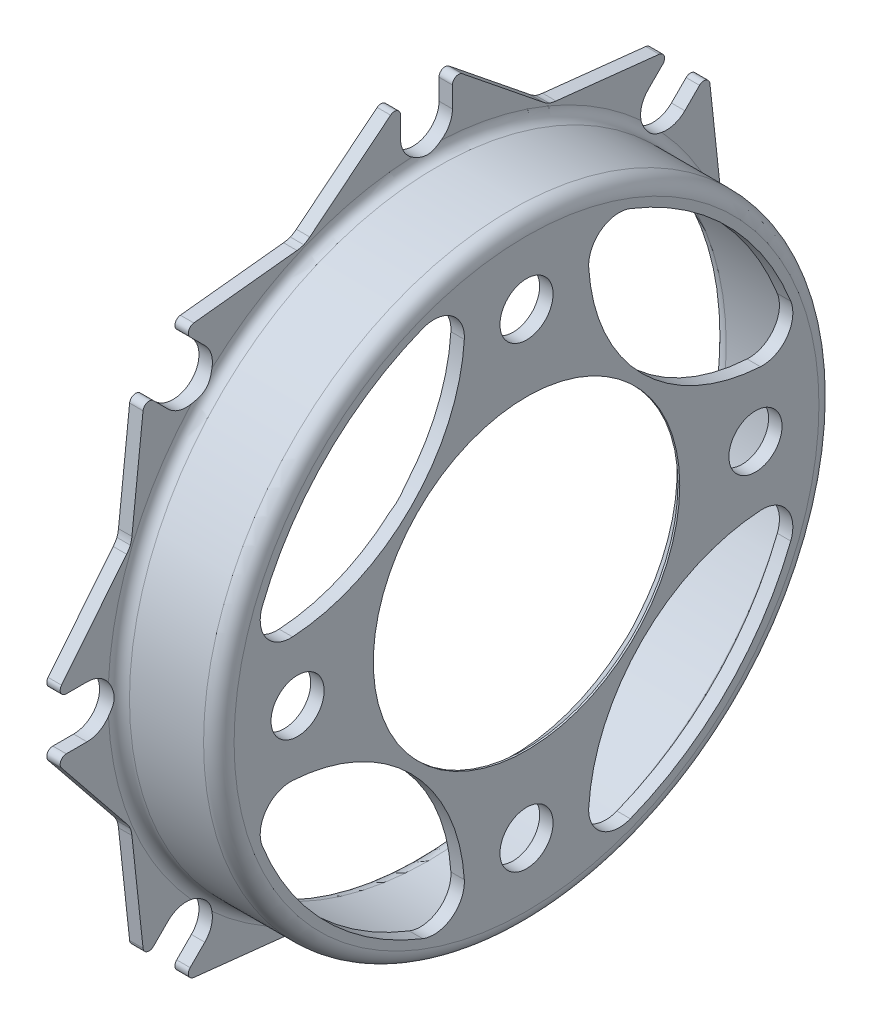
SolidWorks part; units mm, degrees
ref_plane "Front Plane" through (0, 0, 0) normal (0, 0, 1) x (1, 0, 0)
ref_plane "Top Plane" through (0, 0, 0) normal (0, 1, 0) x (1, 0, 0)
ref_plane "Right Plane" through (0, 0, 0) normal (1, 0, 0) x (0, 0, -1)
sketch "Sketch1" plane through (0, 0, 0) normal (0, 0, 1) x (1, 0, 0)
  line L0 (20.8102, 34.1272) -> (20.8102, 59.7535)
  line L1 (18.5877, 61.976) -> (3.175, 61.976)
  line L2 (0, 65.151) -> (0, 88.9)
  line L3 (0, 88.9) -> (2.794, 88.9)
  line L4 (2.794, 88.9) -> (2.794, 66.2305)
  line L5 (5.0165, 64.008) -> (20.4292, 64.008)
  line L6 (23.6042, 60.833) -> (23.6042, 31.877)
  line L7 (23.6042, 31.877) -> (23.2232, 31.877)
  line L8 (20.8102, 34.1272) -> (23.2232, 31.877)
  arc A0 (20.4292, 64.008) -> (23.6042, 60.833) centre (20.4292, 60.833) cw
  arc A1 (18.5877, 61.976) -> (20.8102, 59.7535) centre (18.5877, 59.7535) cw
  arc A2 (0, 65.151) -> (3.175, 61.976) centre (3.175, 65.151) ccw
  arc A3 (2.794, 66.2305) -> (5.0165, 64.008) centre (5.0165, 66.2305) ccw
  dimension "D8" = 3.175
  dimension "D9" = 2.2225
  dimension "D10" = 0.381
  dimension "D1" = 64.008
  dimension "D2" = 88.9
  dimension "D3" = 2.032
  dimension "D4" = 2.794
  dimension "D5" = 2.794
  dimension "D6" = 31.877
  dimension "D7" = 23.6042
  dimension "D11" = 47
ref_axis "Axis1" through (24.7844, 0, 0) along (-1, 0, 0)
revolve "Revolve1" add sketch "Sketch1" angle 360 about axis through (24.7844, 0, 0) along (-1, 0, 0)
sketch "Sketch2" plane through (23.6042, 0, 0) normal (1, 0, 0) x (0, 0, -1)
  circle A0 centre (0, 47.625) radius 5.5245
  dimension "D2" = 11.049
  dimension "D1" = 47.625
extrude "Cut-Extrude1" cut sketch "Sketch2" against normal up to next
pattern_circular "CirPattern1" count 4 every 90 about axis through (0, 0, 0) along (1, 0, 0) of "Cut-Extrude1"
sketch "Sketch3" plane through (23.6042, 0, 0) normal (1, 0, 0) x (0, 0, -1)
  line L0 (0, 0) -> (13.5385, 63.6938) construction
  line L1 (0, 0) -> (60.3937, 12.8371) construction
  line L2 (0, 0) -> (0, 62.2775) construction
  line L3 (0, 0) -> (59.5435, 0) construction
  arc A0 (54.9619, 21.6027) -> (21.6027, 54.9619) centre (0, 0) ccw
  arc A1 (12.9415, 48.6681) -> (48.6681, 12.9415) centre (50.9718, 50.9718) ccw
  arc A2 (12.9415, 48.6681) -> (21.6027, 54.9619) centre (19.2799, 49.0521) cw
  arc A3 (54.9619, 21.6027) -> (48.6681, 12.9415) centre (49.0521, 19.2799) cw
  point P15 (-64.0983, -8.6683)
  dimension "D1" = 12
  dimension "D2" = 12
  dimension "D7" = 2.54
  dimension "D3" = 59.055
  dimension "D5" = 2.54
  dimension "D6" = 38.1
  dimension "D4" = 6.35
extrude "Cut-Extrude2" cut sketch "Sketch3" against normal up to next
pattern_circular "CirPattern2" count 4 every 90 about axis through (0, 0, 0) along (1, 0, 0) of "Cut-Extrude2"
sketch "Sketch5" plane through (0, 0, 0) normal (-1, 0, 0) x (0, 0, 1)
  line L0 (-7.464, 75.9192) -> (-24.2802, 62.3787)
  line L1 (7.464, 75.9192) -> (24.2802, 62.3787)
  line L2 (-5.3975, 74.93) -> (-5.3975, 70.612)
  line L3 (5.3975, 70.612) -> (5.3975, 74.93)
  line L4 (0, 0) -> (-61.2529, 147.8776) construction
  line L5 (0, 0) -> (61.0786, 147.4569) construction
  line L6 (0, 0) -> (0, 165.0951) construction
  line L7 (-34.0206, 82.1329) -> (-25.5154, 61.5997)
  line L8 (34.0206, 82.1329) -> (25.5154, 61.5997)
  arc A0 (-5.3975, 74.93) -> (-7.464, 75.9192) centre (-6.6675, 74.93) ccw
  arc A2 (-5.3975, 70.612) -> (5.3975, 70.612) centre (0, 70.612) ccw
  arc A3 (7.464, 75.9192) -> (5.3975, 74.93) centre (6.6675, 74.93) ccw
  circle A5 centre (0, 0) radius 88.9 construction
  arc A8 (-24.2802, 62.3787) -> (-25.5154, 61.5997) centre (-28.2627, 67.3246) cw
  arc A9 (34.0206, 82.1329) -> (-34.0206, 82.1329) centre (0, 0) ccw
  circle A10 centre (0, 0) radius 88.9 construction
  arc A12 (25.5154, 61.5997) -> (24.2802, 62.3787) centre (28.2627, 67.3246) cw
  circle A14 centre (0, 0) radius 66.675 construction
  point P12 (-18.9836, 61.8592)
  dimension "D6" = 1.27
  dimension "D7" = 6.35
  dimension "D5" = 70.612
  dimension "D13" = 74.93
  dimension "D9" = 66.675
  dimension "D2" = 133.35
  dimension "D4" = 66.675
  dimension "D10" = 21.59
  dimension "D3" = 74.93
  dimension "D8" = 10.795
  dimension "D11" = 45
  dimension "D12" = 22.5
  dimension "D14" = 21.59
extrude "Cut-Extrude4" cut sketch "Sketch5" against normal through all
pattern_circular "CirPattern4" count 8 over 360 about axis through (0, 0, 0) along (1, 0, 0) of "Cut-Extrude4"
ref_plane "Plane1" [suppressed] through (0, 0, 0) normal (0, 0.9239, -0.3827) x (-1, 0, 0)
sketch "Sketch6" [suppressed] plane through (0, 0, 0) normal (0, 0.9239, -0.3827) x (1, 0, 0)
  line L0 (18.2766, 11.43) -> (18.2766, -11.43)
  line L2 (7.1641, -11.43) -> (7.1641, 11.43)
  line L4 (20.4292, 64.008) -> (20.4292, -64.008) construction
  arc A0 (18.2766, 11.43) -> (7.1641, 11.43) centre (12.7203, 11.43) ccw
  arc A1 (7.1641, -11.43) -> (18.2766, -11.43) centre (12.7203, -11.43) ccw
  dimension "D3" = 7.1641
  dimension "D5" = 5.5562
  dimension "D6" = 5.5562
  dimension "D1" = 11.1125
  dimension "D2" = 2.1526
  dimension "D4" = 22.86
  dimension "D7" = 11.43
extrude "Cut-Extrude5" [suppressed] cut sketch "Sketch6" against normal up to next
pattern_circular "CirPattern5" [suppressed] count 8 over 360 about axis through (24.7844, 0, 0) along (-1, 0, 0)
